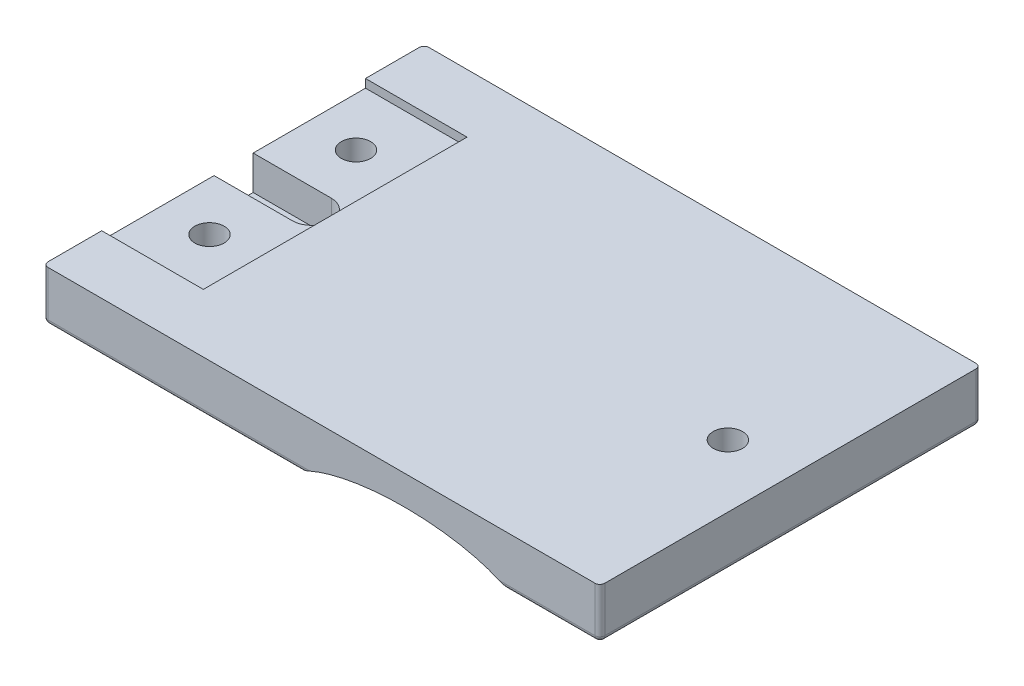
SolidWorks part; units mm, degrees
ref_plane "Front Plane" through (0, 0, 0) normal (0, 0, 1) x (1, 0, 0)
ref_plane "Top Plane" through (0, 0, 0) normal (0, 1, 0) x (1, 0, 0)
ref_plane "Right Plane" through (0, 0, 0) normal (1, 0, 0) x (0, 0, -1)
sketch "Sketch1" plane through (0, 0, 0) normal (0, 1, 0) x (1, 0, 0)
  line L1 (-44.7364, 7.8014) -> (12.2636, 7.8014)
  line L2 (-44.7364, 7.8014) -> (-44.7364, -31.1986)
  line L3 (-44.7364, -31.1986) -> (12.2636, -31.1986)
  line L4 (12.2636, 7.8014) -> (12.2636, -31.1986)
  dimension "D1" = 57
  dimension "D2" = 39
extrude "Boss-Extrude1" add sketch "Sketch1" along normal blind 5.15
sketch "Sketch2" plane through (0, 5.15, 0) normal (0, 1, 0) x (1, 0, 0)
  line L0 (-44.7364, 7.8014) -> (-44.7364, -31.1986) construction
  line L2 (-34.3364, -25.1986) -> (-44.7364, -25.1986)
  line L3 (-34.3364, -25.1986) -> (-34.3364, 1.8014)
  line L4 (-34.3364, 1.8014) -> (-44.7364, 1.8014)
  line L6 (12.2636, -11.6986) -> (-44.7364, -11.6986) construction
  line L7 (12.2636, -31.1986) -> (12.2636, 7.8014) construction
  line L8 (-44.7364, -25.1986) -> (-44.7364, 1.8014)
  line L9 (-34.3364, -25.1986) -> (-44.7364, 1.8014) construction
  line L10 (-34.3364, 1.8014) -> (-44.7364, -25.1986) construction
  point P0 (-39.5364, -11.6986)
  dimension "D1" = 10.4
  dimension "D2" = 27
extrude "Cut-Extrude1" cut sketch "Sketch2" against normal blind 0.86
sketch "Sketch4" plane through (0, 0, 31.1986) normal (0, 0, 1) x (1, 0, 0)
  line L0 (-20.2364, -2.35) -> (4.7636, -2.35)
  line L1 (-44.7364, 5.15) -> (-44.7364, 0) construction
  ellipse E0 centre (-7.7364, -2.35) end of major axis (-20.2364, -2.35) minor radius 4.5 (4.7636, -2.35) -> (-20.2364, -2.35) ccw
  dimension "D2" = 37
  dimension "D3" = 9
  dimension "D4" = 25
  dimension "D1" = 7.5
extrude "Cut-Extrude3" cut sketch "Sketch4" against normal through all
fillet "Fillet1" radius 0.5 12 edges at (12.2636, 2.575, -7.8014) (-44.7364, 2.575, -7.8014) (-44.7364, 2.575, 31.1986) (12.2636, 2.575, 31.1986) (12.2636, 0, 11.6986) (7.5937, 0, -7.8014) (7.5937, 0, 31.1986) (-31.5665, 0, -7.8014) (-44.7364, 0, 11.6986) (-31.5665, 0, 31.1986) (2.9237, 0, 11.6986) (-18.3965, 0, 11.6986)
hole_wizard "Ø3.0mm Transitional Dowel Hole1" positions "3DSketch2" profile "Sketch9" hole size "Ø3.0" standard "ISO"
sketch3d "3DSketch2"
  line L1 (-44.7364, 4.29, -1.8014) -> (-44.7364, 4.29, 25.1986) construction
  line L2 (-44.7364, 4.29, -1.8014) -> (-44.7364, 4.29, 25.1986) construction
  line L3 (11.7636, 5.15, -7.8014) -> (-44.2364, 5.15, -7.8014) construction
  point P0 (-39.7364, 4.29, 4.1677)
  point P2 (-39.7364, 4.29, 19.1677)
  dimension "D1" = 12
  dimension "D2" = 15
  dimension "D3" = 5
  dimension "D4" = 5
sketch "Sketch9" plane through (-39.7364, 4.29, 4.1677) normal (1, 0, 0) x (0, 0, 1)
  line L0 (0, 0) -> (0, 4.29)
  line L1 (0, 4.29) -> (1.5, 4.29)
  line L2 (1.5, 4.29) -> (1.5, 0)
  line L5 (1.5, 0) -> (0, 0)
  line L11 (0, -6.35) -> (0, 107.95) construction
  dimension "Thru Hole Dia." = 3
  dimension "Thru Hole Depth" = 4.29
hole_wizard "Ø3.0mm Transitional Dowel Hole2" positions "3DSketch3" profile "Sketch10" hole size "Ø3.0" standard "ISO"
sketch3d "3DSketch3"
  line L0 (11.7636, 5.15, -7.8014) -> (-44.2364, 5.15, -7.8014) construction
  line L1 (12.2636, 5.15, 30.6986) -> (12.2636, 5.15, -7.3014) construction
  point P0 (5.8636, 5.15, 11.6986)
  dimension "D1" = 19.5
  dimension "D2" = 6.4
sketch "Sketch10" plane through (5.8636, 5.15, 11.6986) normal (1, 0, 0) x (0, 0, 1)
  line L0 (0, 0) -> (0, 5.15)
  line L1 (0, 5.15) -> (1.5, 5.15)
  line L2 (1.5, 5.15) -> (1.5, 0)
  line L5 (1.5, 0) -> (0, 0)
  line L11 (0, -6.35) -> (0, 107.95) construction
  dimension "Thru Hole Dia." = 3
  dimension "Thru Hole Depth" = 5.15
sketch "Sketch11" plane through (0, 4.29, 0) normal (0, 1, 0) x (1, 0, 0)
  line L0 (-44.7364, -11.6986) -> (-34.3364, -11.6986) construction
  line L1 (-44.7364, 1.8014) -> (-44.7364, -25.1986) construction
  line L2 (-34.3364, -25.1986) -> (-34.3364, 1.8014) construction
  line L4 (-36.7364, -9.6986) -> (-44.7364, -9.6986)
  line L5 (-36.7364, -9.6986) -> (-36.7364, -13.6986)
  line L6 (-36.7364, -13.6986) -> (-44.7364, -13.6986)
  line L7 (-44.7364, -9.6986) -> (-44.7364, -13.6986)
  line L8 (-36.7364, -9.6986) -> (-44.7364, -13.6986) construction
  line L9 (-36.7364, -13.6986) -> (-44.7364, -9.6986) construction
  arc A0 (-36.7364, -13.6986) -> (-36.7364, -9.6986) centre (-36.7364, -11.6986) ccw
  point P6 (-40.7364, -11.6986)
  dimension "D1" = 8
  dimension "D2" = 4
extrude "Cut-Extrude4" cut sketch "Sketch11" against normal blind 3.5 contours L6 L5 L4 M3 M4 | L5 A0
